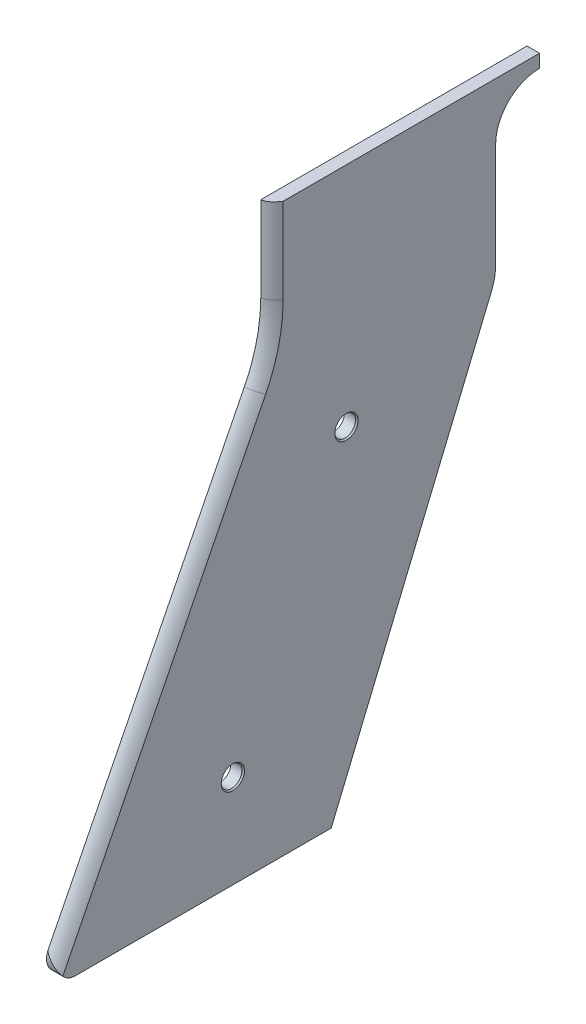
SolidWorks part; units mm, degrees
other "DetailItem1" parameters "D1"=7.62, "D2"=7.62
ref_plane "Front Plane" through (0, 0, 0) normal (0, 0, 1) x (1, 0, 0)
ref_plane "Top Plane" through (0, 0, 0) normal (0, 1, 0) x (1, 0, 0)
ref_plane "Right Plane" through (0, 0, 0) normal (1, 0, 0) x (0, 0, -1)
sketch "Sketch1"
extrude "Boss-Extrude1" add sketch "Sketch1" along normal blind 4.572
fillet "Fillet1" radius 6.35 3 edges at (4.572, 87.349, -9.2505) (4.572, 73.1327, -8.4912) (4.572, 29.3483, 12.7248)
sketch "Sketch3" plane through (4.572, 0, 0) normal (1, 0, 0) x (0, 0, -1)
  line L0 (6.2546, 67.0076) -> (-31.7041, -8.311) construction
  line L1 (-31.7041, -8.311) -> (-17.6225, -8.311) construction
  line L2 (-26.8327, -8.311) -> (-26.8327, -9.0409)
  line L3 (-26.8327, -9.0409) -> (-31.9127, -9.0409)
  line L4 (-31.9127, -9.0409) -> (-31.9127, -3.9609)
  line L5 (-31.9127, -3.9609) -> (-29.5118, -3.9609)
  arc A0 (-26.8327, -8.311) -> (-29.5118, -3.9609) centre (-26.8327, -5.311) cw
  arc A1 (-29.5118, -3.9609) -> (-26.8327, -8.311) centre (-26.8327, -5.311) ccw construction
  dimension "D1" = 5.08
  dimension "D2" = 5.08
extrude "Cut-Extrude1" cut sketch "Sketch3" against normal through all
chamfer "Chamfer1" distance 2.54 angle 41 2 edges at (4.572, 8.689, -3.7821) (4.572, 53.689, -24.4966)
sketch "Sketch4" plane through (0, 95.089, 0) normal (0, 1, 0) x (1, 0, 0)
  line L0 (4.572, 57.8075) -> (0, 57.8075) construction
  line L1 (2.286, 57.8075) -> (27.686, 57.8075)
  line L2 (2.286, 57.8075) -> (2.286, -35.1477)
  line L3 (2.286, -35.1477) -> (27.686, -35.1477)
  line L4 (27.686, 57.8075) -> (27.686, -35.1477)
  dimension "D1" = 25.4
  dimension "D2" = 92.9551
extrude "Cut-Extrude2" cut sketch "Sketch4" against normal through all
